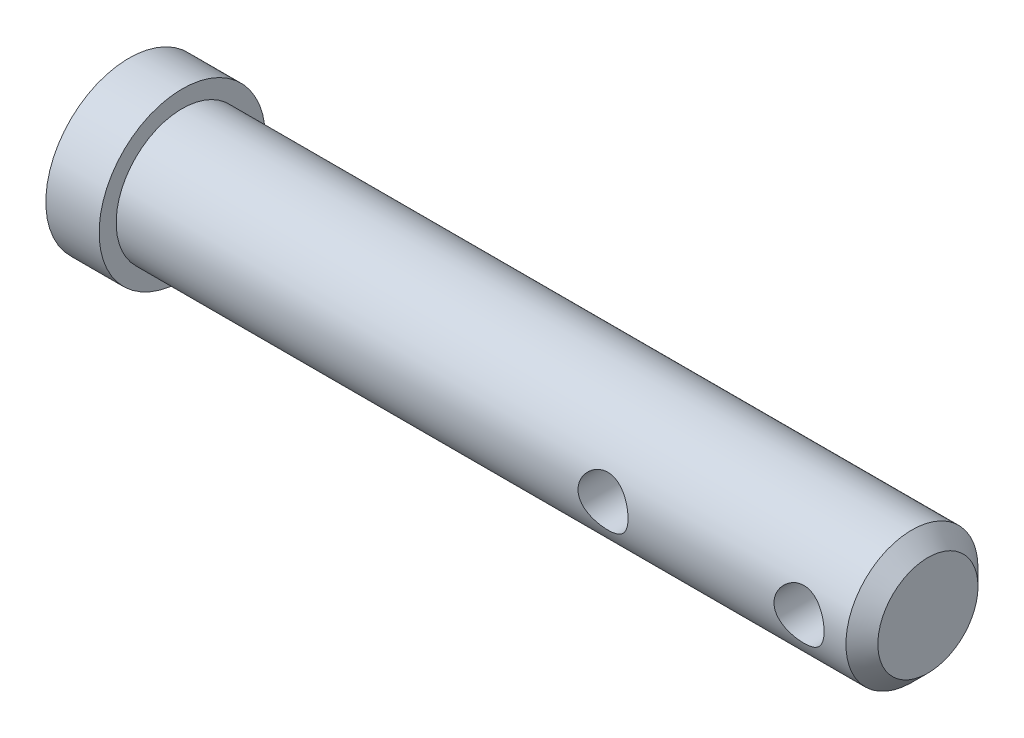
SolidWorks part; units mm, degrees
ref_plane "Plane1" through (0, 0, 0) normal (0, 0, 1) x (1, 0, 0)
ref_plane "Plane2" through (0, 0, 0) normal (0, 1, 0) x (1, 0, 0)
ref_plane "Plane3" through (0, 0, 0) normal (1, 0, 0) x (0, 0, -1)
sketch "Sketch1" plane through (0, 0, 0) normal (0, 0, 1) x (1, 0, 0)
  line L0 (-19.05, 0) -> (-19.05, 3.9624)
  line L1 (-19.05, 3.9624) -> (-16.51, 3.9624)
  line L2 (-16.51, 3.9624) -> (-16.51, 3.1496)
  line L3 (-16.51, 3.1496) -> (19.05, 3.1496)
  line L4 (19.05, 3.1496) -> (19.05, 0)
  line L5 (19.05, 0) -> (-19.05, 0)
  line L6 (-19.05, 0) -> (-26.1269, 0) construction
  point P1 (0, 0)
  dimension "D1" = 6.2992
  dimension "D2" = 38.1
  dimension "D3" = 2.54
  dimension "D4" = 7.9248
revolve "Base-Revolve" add sketch "Sketch1" angle 360 about L6
sketch "Sketch2" plane through (0, 0, 0) normal (0, 0, 1) x (1, 0, 0)
  line L0 (0, 0) -> (16.0528, 0) construction
  line L2 (0, 0) -> (0, -5.3994) construction
  line L4 (-16.51, -3.9624) -> (-16.51, 3.9624) construction
  line L5 (19.05, -3.1496) -> (19.05, 3.1496) construction
  circle A0 centre (16.0528, 0) radius 1.1938
  circle A2 centre (6.7056, 0) radius 1.1938
  dimension "D2" = 2.3876
  dimension "D1" = 23.2156
  dimension "D4" = 2.9972
  dimension "D3" = 32.5628
extrude "Cut-Extrude1" cut sketch "Sketch2" against normal through all and the other way through all
chamfer "Chamfer1" distance 0.762 angle 45
